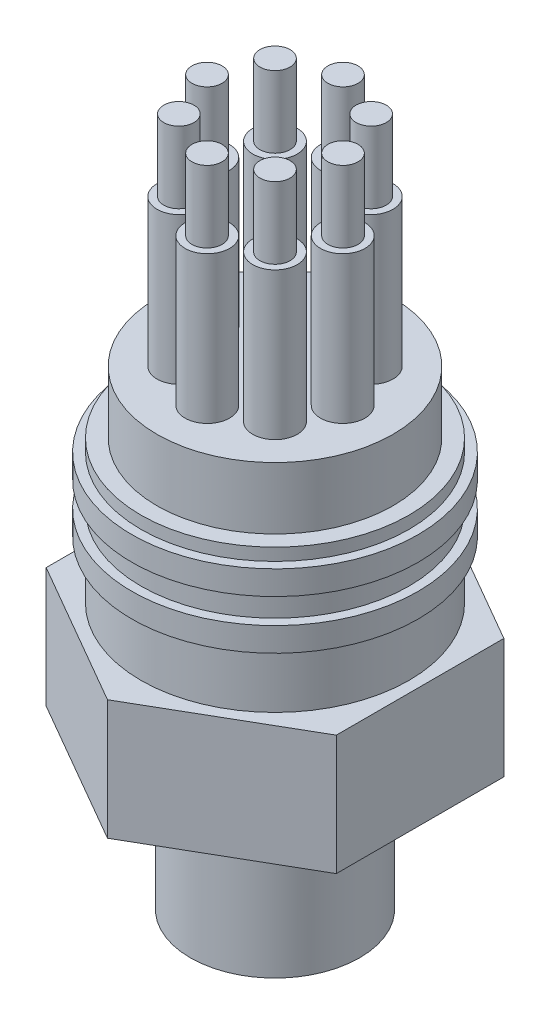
SolidWorks part; units mm, degrees
ref_plane "Front" through (0, 0, 0) normal (0, 0, 1) x (1, 0, 0)
ref_plane "Top" through (0, 0, 0) normal (0, 1, 0) x (1, 0, 0)
ref_plane "Right" through (0, 0, 0) normal (1, 0, 0) x (0, 0, -1)
sketch "Sketch1" plane through (0, 0, 0) normal (0, 1, 0) x (1, 0, 0)
  line L1 (0, 10.9985) -> (-9.525, 5.4993)
  line L2 (-9.525, 5.4993) -> (-9.525, -5.4993)
  line L3 (-9.525, -5.4993) -> (0, -10.9985)
  line L4 (0, -10.9985) -> (9.525, -5.4993)
  line L5 (9.525, -5.4993) -> (9.525, 5.4993)
  line L6 (9.525, 5.4993) -> (0, 10.9985)
  circle A0 centre (0, 0) radius 9.525 construction
  dimension "D1" = 19.05
extrude "Extrude1" add sketch "Sketch1" along normal blind 7.874
sketch "Sketch2" plane through (0, 0, 0) normal (0, 0, 1) x (1, 0, 0)
  line L0 (0, 0) -> (0, -1.8388) construction
  line L1 (8.8011, 7.874) -> (8.8011, 11.6586)
  line L2 (0, 7.874) -> (9.525, 7.874) construction
  line L3 (8.8011, 11.6586) -> (9.398, 11.6586)
  line L4 (9.398, 11.6586) -> (9.398, 13.2334)
  line L5 (9.398, 13.2334) -> (8.8011, 13.2334)
  line L6 (8.8011, 13.2334) -> (8.8011, 14.8844)
  line L7 (8.8011, 14.8844) -> (9.398, 14.8844)
  line L8 (9.398, 14.8844) -> (9.398, 16.4592)
  line L9 (9.398, 16.4592) -> (8.8011, 16.4592)
  line L10 (8.8011, 16.4592) -> (8.8011, 17.272)
  line L11 (8.8011, 17.272) -> (0, 17.272)
  line L12 (0, 17.272) -> (0, 7.874)
  line L13 (-9.398, 11.6586) -> (-9.398, 13.2334) construction
  line L14 (-8.8011, 7.874) -> (-8.8011, 11.6586) construction
  line L15 (8.8011, 7.874) -> (0, 7.874)
  dimension "D1" = 17.6022
  dimension "D2" = 18.796
  dimension "D3" = 1.5748
  dimension "D4" = 1.651
  dimension "D5" = 0.8128
  dimension "D6" = 9.398
revolve "Revolve1" add sketch "Sketch2" angle 360 about L0
sketch "Sketch3" plane through (0, 17.272, 0) normal (0, 1, 0) x (-1, 0, 0)
  circle A0 centre (0, 0) radius 7.747
  dimension "D1" = 15.494
extrude "Extrude2" add sketch "Sketch3" along normal blind 4.064
sketch "Sketch4" plane through (0, 21.336, 0) normal (0, 1, 0) x (-1, 0, 0)
  circle A0 centre (0, -4.445) radius 1.4605
  circle A1 centre (0, 0) radius 4.445 construction
  dimension "D1" = 2.921
  dimension "D2" = 8.89
extrude "Extrude3" add sketch "Sketch4" along normal blind 9.652
sketch "Sketch5" plane through (0, 30.988, 0) normal (0, 1, 0) x (-1, 0, 0)
  circle A0 centre (0, -4.4639) radius 0.9906
  dimension "D1" = 1.9812
extrude "Extrude4" add sketch "Sketch5" along normal blind 4.699
pattern_circular "CirPattern1" count 8 over 360 about axis through (0, 0, 0) along (0, 1, 0) of "Extrude3", "Extrude4"
sketch "1" plane through (0.0995, 21.336, 4.4802) normal (0, 1, 0) x (-1, 0, 0)
  circle A0 centre (0.0995, -4.4802) radius 1.4605
  dimension "D1" = 2.921
extrude "Extrude5" [suppressed] add sketch "1" along normal blind 9.652
sketch "2" [suppressed] plane through (0.0995, 30.988, 4.4802) normal (0, 1, 0) x (-1, 0, 0)
  circle A0 centre (0.0995, -4.4802) radius 0.9906
  dimension "D1" = 1.9812
extrude "Extrude6" [suppressed] add sketch "2" along normal blind 4.699
sketch "Sketch8" plane through (0, 0, 0) normal (0, -1, 0) x (1, 0, 0)
  circle A0 centre (0, 0) radius 5.5562
  dimension "D1" = 11.1125
extrude "Extrude7" add sketch "Sketch8" along normal blind 18.2803
sketch "Sketch9" plane through (0, 0, 0) normal (0, 0, 1) x (1, 0, 0)
  line L0 (0, 0) -> (0, -1.4263) construction
  circle A0 centre (7.1, 0.2843) radius 0.89
  circle A1 centre (-7.1, 0.2843) radius 0.89 construction
  dimension "D1" = 1.78
  dimension "D2" = 12.42
revolve "o-ring 12.42x1.78" add sketch "Sketch9" angle 360 about L0
sketch "Sketch10" plane through (0, 0, 0) normal (0, 0, 1) x (1, 0, 0)
  line L0 (9.0805, 8.5119) -> (9.0805, 11.5824)
  line L1 (9.0805, 11.5824) -> (9.9445, 11.5824)
  line L2 (9.9445, 11.5824) -> (9.9445, 13.2334)
  line L3 (9.9445, 13.2334) -> (9.0805, 13.2334)
  line L4 (9.398, 13.2334) -> (-9.398, 13.2334) construction
  line L5 (9.0805, 13.2334) -> (9.0805, 14.7574)
  line L6 (9.0805, 14.7574) -> (9.9445, 14.7574)
  line L7 (9.9445, 14.7574) -> (9.9445, 19.0036)
  line L8 (9.9445, 19.0036) -> (7.9756, 19.0036)
  line L9 (7.9756, 19.0036) -> (7.9756, 49.6599)
  line L10 (9.0805, 8.5119) -> (11.049, 8.5119)
  line L11 (11.049, 8.5119) -> (11.049, 49.6599)
  line L12 (11.049, 49.6599) -> (7.9756, 49.6599)
  line L13 (0, 0) -> (0, 44.7429) construction
  line L14 (-11.049, 8.5119) -> (-11.049, 49.6599) construction
  line L15 (-9.9445, 11.5824) -> (-9.9445, 13.2334) construction
  line L16 (-9.0805, 8.5119) -> (-9.0805, 11.5824) construction
  line L17 (-7.9756, 19.0036) -> (-7.9756, 49.6599) construction
  dimension "D1" = 41.148
  dimension "D2" = 18.161
  dimension "D3" = 15.9512
  dimension "D4" = 1.651
  dimension "D5" = 1.524
  dimension "D6" = 22.098
  dimension "D7" = 3.0705
revolve "Locking Sleeve" [suppressed] add sketch "Sketch10" angle 360 about L13
ref_plane "Plane1" through (0, -9.525, 0) normal (0, -1, 0) x (1, 0, 0)
sketch "Sketch11" plane through (0, -9.525, 0) normal (0, -1, 0) x (1, 0, 0)
  circle A0 centre (0, 0) radius 6.2566
extrude "Cut-Extrude1" cut sketch "Sketch11" along normal blind 25.4
